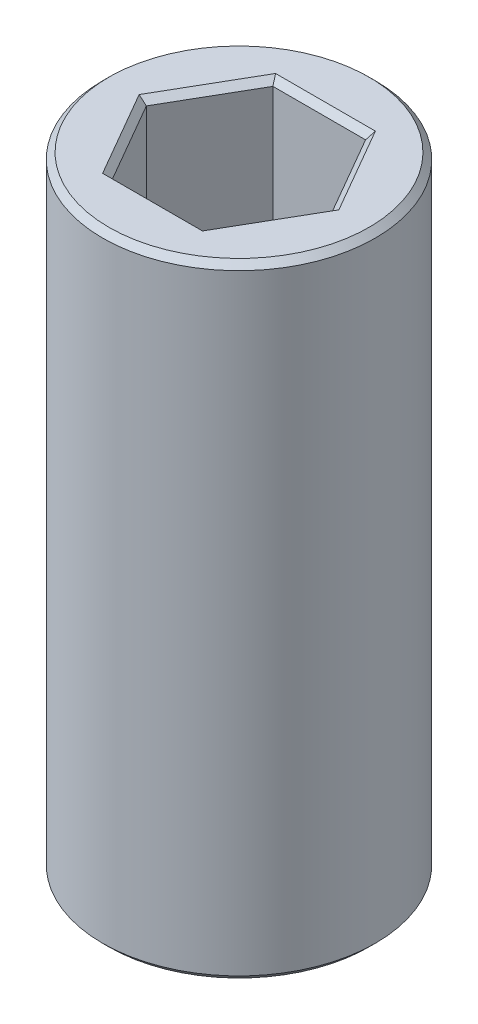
SolidWorks part; units mm, degrees
ref_plane "Front Plane" through (0, 0, 0) normal (0, 0, 1) x (1, 0, 0)
ref_plane "Top Plane" through (0, 0, 0) normal (0, 1, 0) x (1, 0, 0)
ref_plane "Right Plane" through (0, 0, 0) normal (1, 0, 0) x (0, 0, -1)
sketch "Sketch1" plane through (0, 0, 0) normal (0, 1, 0) x (1, 0, 0)
  line L1 (7.5523, 0) -> (3.7762, 6.5405)
  line L2 (3.7762, 6.5405) -> (-3.7762, 6.5405)
  line L3 (-3.7762, 6.5405) -> (-7.5523, 0)
  line L4 (-7.5523, 0) -> (-3.7762, -6.5405)
  line L5 (-3.7762, -6.5405) -> (3.7762, -6.5405)
  line L6 (3.7762, -6.5405) -> (7.5523, 0)
  circle A0 centre (0, 0) radius 11.1125
  circle A1 centre (0, 0) radius 6.5405 construction
  dimension "D1" = 13.081
  dimension "D2" = 22.225
extrude "Boss-Extrude1" add sketch "Sketch1" along normal blind 50.8
chamfer "Chamfer1" distance 0.508 angle 45 14 edges at (5.6642, 0, -3.2703) (0, 0, -6.5405) (-5.6642, 0, -3.2702) (-5.6642, 0, 3.2703) (0, 0, 6.5405) (5.6642, 0, 3.2702) (0, 0, 11.1125) (0, 50.8, 11.1125) (-5.6642, 50.8, -3.2702) (-5.6642, 50.8, 3.2703) (0, 50.8, 6.5405) (5.6642, 50.8, 3.2702) (5.6642, 50.8, -3.2703) (0, 50.8, -6.5405)
